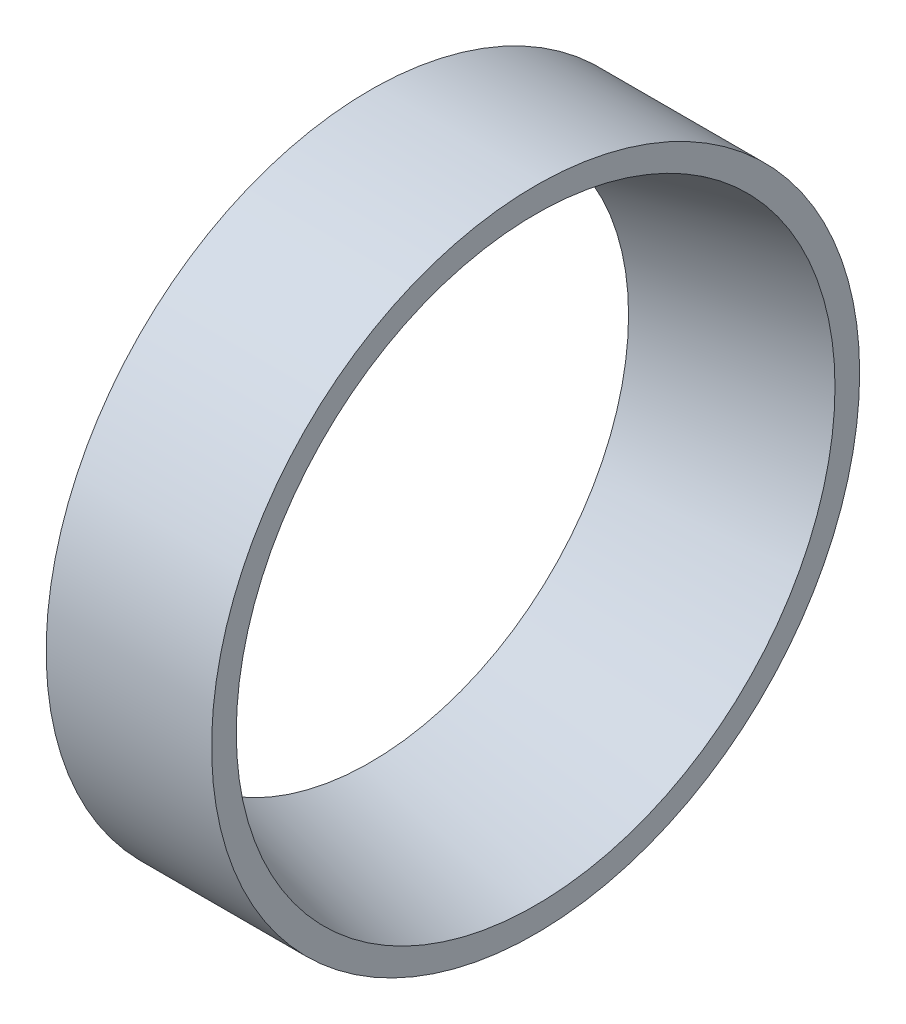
SolidWorks part; units mm, degrees
ref_plane "Plan1" through (0, 0, 0) normal (0, 0, 1) x (1, 0, 0)
ref_plane "Plan2" through (0, 0, 0) normal (0, 1, 0) x (1, 0, 0)
ref_plane "Plan3" through (0, 0, 0) normal (1, 0, 0) x (0, 0, -1)
sketch "Esquisse1" plane through (0, 0, 0) normal (0, 0, 1) x (1, 0, 0)
  line L0 (0, 21.712) -> (0, 23.5)
  line L1 (0, 23.5) -> (-12, 23.5)
  line L2 (-12, 23.5) -> (-12, 18.74)
  line L3 (-12, 18.74) -> (0, 21.712)
  line L4 (40, 0) -> (-40, 0) construction
  dimension "D1" = 1.788
  dimension "D2" = 12
  dimension "D3" = 4.76
  dimension "D4" = 23.5
revolve "Base-Révolution" add sketch "Esquisse1" angle 360 about L4
